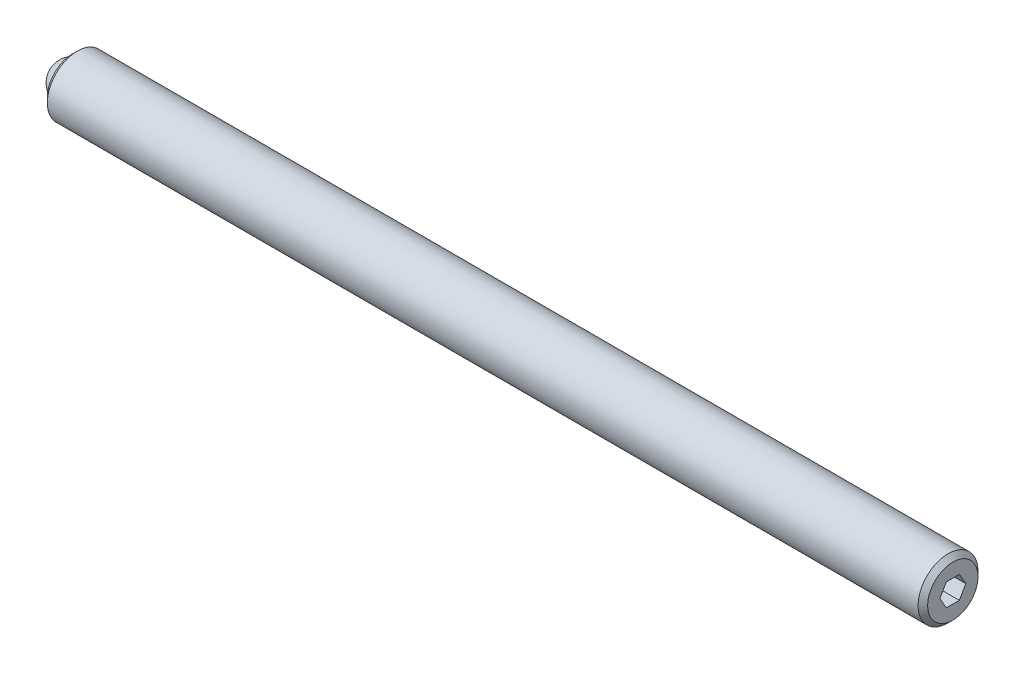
SolidWorks part; units mm, degrees
ref_plane "Front Plane" through (0, 0, 0) normal (0, 0, 1) x (1, 0, 0)
ref_plane "Top Plane" through (0, 0, 0) normal (0, 1, 0) x (1, 0, 0)
ref_plane "Right Plane" through (0, 0, 0) normal (1, 0, 0) x (0, 0, -1)
sketch "Sketch2" plane through (0, 0, 0) normal (1, 0, 0) x (0, 0, -1)
  circle A0 centre (0, 0) radius 3.175
  dimension "D1" = 6.35
extrude "Boss-Extrude1" add sketch "Sketch2" along normal blind 93.2656
sketch "Sketch3" plane through (0, 0, 0) normal (-1, 0, 0) x (0, 0, 1)
  circle A0 centre (0, 0) radius 1.9812
  dimension "D1" = 3.9624
chamfer "Chamfer1" distance 0.508 angle 45 1 edges at (0, 0, -3.175)
chamfer "Chamfer2" distance 0.508 angle 45 1 edges at (93.2656, 0, -3.175)
sketch "Sketch4" plane through (93.2656, 0, 0) normal (1, 0, 0) x (0, 0, -1)
  line L1 (1.3748, 0) -> (0.6874, 1.1906)
  line L2 (0.6874, 1.1906) -> (-0.6874, 1.1906)
  line L3 (-0.6874, 1.1906) -> (-1.3748, 0)
  line L4 (-1.3748, 0) -> (-0.6874, -1.1906)
  line L5 (-0.6874, -1.1906) -> (0.6874, -1.1906)
  line L6 (0.6874, -1.1906) -> (1.3748, 0)
  circle A0 centre (0, 0) radius 1.1906 construction
  dimension "D1" = 2.3813
extrude "Cut-Extrude2" cut sketch "Sketch4" against normal blind 2.286
extrude "Cut-Extrude3" cut sketch "Sketch3" against normal blind 1.9844
sketch "Sketch5" plane through (0, 0, 0) normal (-1, 0, 0) x (0, 0, 1)
  line L0 (0, 0) -> (0, -1.9844)
  line L1 (0, 0) -> (0, 1.9844)
  arc A0 (0, 1.9844) -> (0, -1.9844) centre (0, 0) ccw
  dimension "D1" = 1.9844
revolve "Revolve1" add sketch "Sketch5" angle 360 about L1
